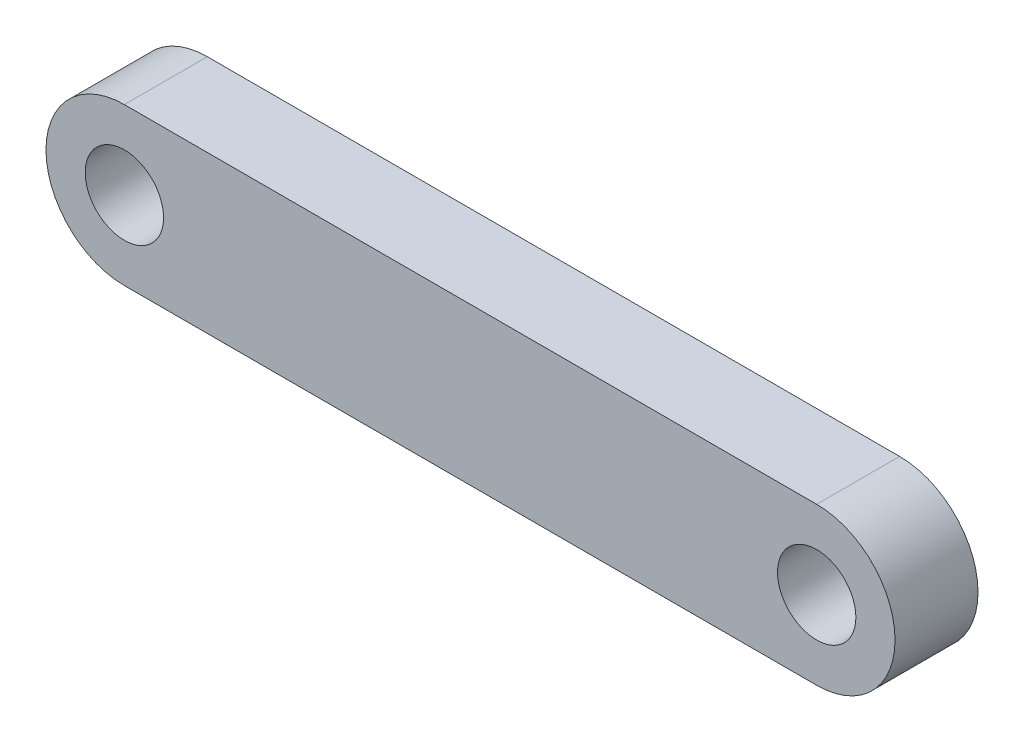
SolidWorks part; units mm, degrees
ref_plane "Front Plane" through (0, 0, 0) normal (0, 0, 1) x (1, 0, 0)
ref_plane "Top Plane" through (0, 0, 0) normal (0, 1, 0) x (1, 0, 0)
ref_plane "Right Plane" through (0, 0, 0) normal (1, 0, 0) x (0, 0, -1)
sketch "Sketch1" plane through (0, 0, 0) normal (0, 0, 1) x (1, 0, 0)
  line L0 (-53, 0) -> (53, 0) construction
  line L1 (-53, 12) -> (53, 12)
  line L2 (-53, -12) -> (53, -12)
  circle A0 centre (-53, 0) radius 6
  circle A1 centre (53, 0) radius 6
  arc A2 (-53, 12) -> (-53, -12) centre (-53, 0) ccw
  arc A3 (53, -12) -> (53, 12) centre (53, 0) ccw
  point P4 (0, 0)
  dimension "D2" = 12
  dimension "D3" = 24
  dimension "D4" = 24
  dimension "D1" = 106
extrude "Boss-Extrude1" add sketch "Sketch1" along normal blind 12.7
